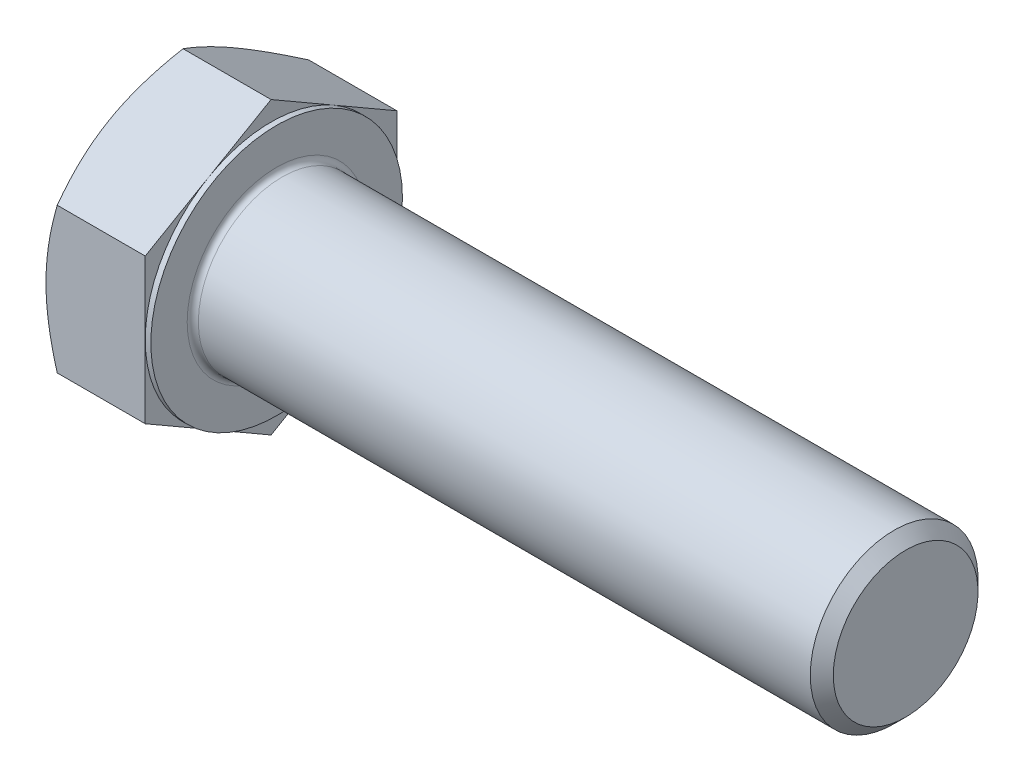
SolidWorks part; units mm, degrees
ref_plane "Plane1" through (0, 0, 0) normal (0, 0, 1) x (1, 0, 0)
ref_plane "Plane2" through (0, 0, 0) normal (0, 1, 0) x (1, 0, 0)
ref_plane "Plane3" through (0, 0, 0) normal (1, 0, 0) x (0, 0, -1)
extrude "BaseHead" add sketch "Sketch1" along normal blind 15
sketch "Sketch1" plane through (0, 0, 0) normal (1, 0, 0) x (0, 0, -1)
  line L0 (18, 10.3923) -> (18, -10.3923)
  line L1 (-18, 10.3923) -> (-18, -10.3923)
  line L2 (18, -10.3923) -> (0, -20.7846)
  line L3 (0, -20.7846) -> (-18, -10.3923)
  line L4 (18, 10.3923) -> (0, 20.7846)
  line L5 (0, 20.7846) -> (-18, 10.3923)
  dimension "Width_flats" = 36
  dimension "D2" = 120
  dimension "D3" = 18
  dimension "D4" = 18
  dimension "D5" = 18
revolve "BearingFace" cut sketch "Sketch4"
sketch "Sketch4"
  line L1 (15, 20.7846) -> (15, 10.3923) construction
  line L2 (15, 18) -> (14.2, 18)
  line L3 (15, 18) -> (15, 30.7846)
  line L4 (15, 30.7846) -> (14.2, 30.7846)
  line L5 (0, 0) -> (95.25, 0) construction
  line L6 (0, 0) -> (96.52, 0) construction
  line L7 (14.2, 18) -> (14.2, 30.7846)
  line L8 (15, 20.7846) -> (1.6077, 20.7846) construction
revolve "HeadChamfer" cut sketch "Sketch3" angle 360 about L6
sketch "Sketch3" plane through (0, 0, 0) normal (0, 0, 1) x (1, 0, 0)
  line L0 (0, 18) -> (4.4944, 25.7846)
  line L1 (0, 20.7846) -> (0, 10.3923) construction
  line L2 (4.4944, 25.7846) -> (4.4944, 30.7846)
  line L3 (4.4944, 30.7846) -> (-10, 30.7846)
  line L4 (-10, 30.7846) -> (-10, 18)
  line L5 (-10, 18) -> (0, 18)
  line L6 (0, 0) -> (99.06, 0) construction
  line L7 (15, 20.7846) -> (0, 20.7846) construction
  dimension "D1" = 18
  dimension "D2" = 5
  dimension "D3" = 10
  dimension "D4" = 5
  dimension "Head_ch_ang" = 30
sketch "BodySke" plane through (0, 0, 0) normal (0, 0, 1) x (1, 0, 0)
  line L0 (0, 10.3923) -> (0, -10.3923) construction
  line L1 (0, 0) -> (105, 0)
  line L2 (0, 0) -> (0, 12)
  line L3 (0, 12) -> (103.352, 12)
  line L4 (105, 0) -> (105, 10.352)
  line L5 (15, 20.7846) -> (15, 10.3923) construction
  line L6 (105, 10.352) -> (103.352, 12)
  line L7 (0, 0) -> (96.52, 0) construction
  line L8 (105, -10.352) -> (103.352, -12) construction
  line L9 (0, -12) -> (103.352, -12) construction
  line L10 (18, 15.24) -> (18, -1.27) construction
  line L11 (51, 15.24) -> (51, -1.27) construction
  line L12 (15, 10.3923) -> (15, -10.3923) construction
  dimension "Length" = 90
  dimension "Body_ch_ang" = 45
  dimension "Diameter" = 24
  dimension "Minor_dia" = 20.704
  dimension "Advance" = 3
  dimension "Thread_nom" = 54
revolve "BaseBody" add sketch "BodySke"
fillet "HeadFillet" radius 0.8 1 edges at (15, 0, -12)
sketch "ThdSchSke" plane through (0, 0, 0) normal (0, 0, 1) x (1, 0, 0)
  line L0 (51, -10.352) -> (49.8461, -12)
  line L1 (51, -10.352) -> (52.1539, -12)
  line L2 (52.1539, -12) -> (52.1539, -15)
  line L3 (-3.175, 0) -> (5.1513, 0) construction
  line L5 (52.1539, -15) -> (49.8461, -15)
  line L6 (49.8461, -15) -> (49.8461, -12)
  dimension "Thread_minor" = 20.704
  dimension "Diameter" = 24
  dimension "Start" = 51
  dimension "SideAngle" = 55
  dimension "VeeAngle" = 70
  dimension "Overcut" = 30
revolve "ThreadSchematic" cut sketch "ThdSchSke" angle 360 about L3
pattern_linear "ThdSchPat"
equation "\"D3@Sketch1\" = \"Width_flats@Sketch1\" / 2"
equation "\"D4@Sketch1\" = \"D3@Sketch1\""
equation "\"D5@Sketch1\" = \"D4@Sketch1\""
equation "\"Thread_minor@ThreadCosmetic\" = \"Minor_dia@BodySke\""
equation "\"D1@Sketch3\" = \"Width_flats@Sketch1\" / 2"
equation "\"D1@Sketch4\" = \"Width_flats@Sketch1\""
equation "\"Thread_length@ThreadCosmetic\" = ((sgn( (\"Length@BodySke\" - \"Advance@BodySke\" ) - \"Thread_nom@BodySke\" )-1)*( (\"Length@BodySke\" - \"Advance@BodySke\" ) - \"Thread_nom@BodySke\" ))/-2+ \"Thread_nom@BodySke\""
equation "\"Thread_minor@ThdSchSke\" = \"Minor_dia@BodySke\""
equation "\"Diameter@ThdSchSke\" = \"Diameter@BodySke\""
equation "\"Overcut@ThdSchSke\" = \"Diameter@BodySke\" * 1.25"
equation "\"Start@ThdSchSke\" = \"Head_ht@BaseHead\" + \"Length@BodySke\" - \"Thread_length@ThreadCosmetic\"  '---Non-countersunk---"
equation "\"Num_threads@ThdSchPat\" = int( \"Thread_length@ThreadCosmetic\" / \"Advance@BodySke\" + 0.999 )  + 1"
equation "\"Advance@ThdSchPat\" = \"Thread_length@ThreadCosmetic\" /  (\"Num_threads@ThdSchPat\" - 1) 'relax it"
equation "\"Num_threads@ThdSchPat\" = \"Num_threads@ThdSchPat\" - sgn( \"Num_threads@ThdSchPat\" - 1) '---chamfered tips only---"
